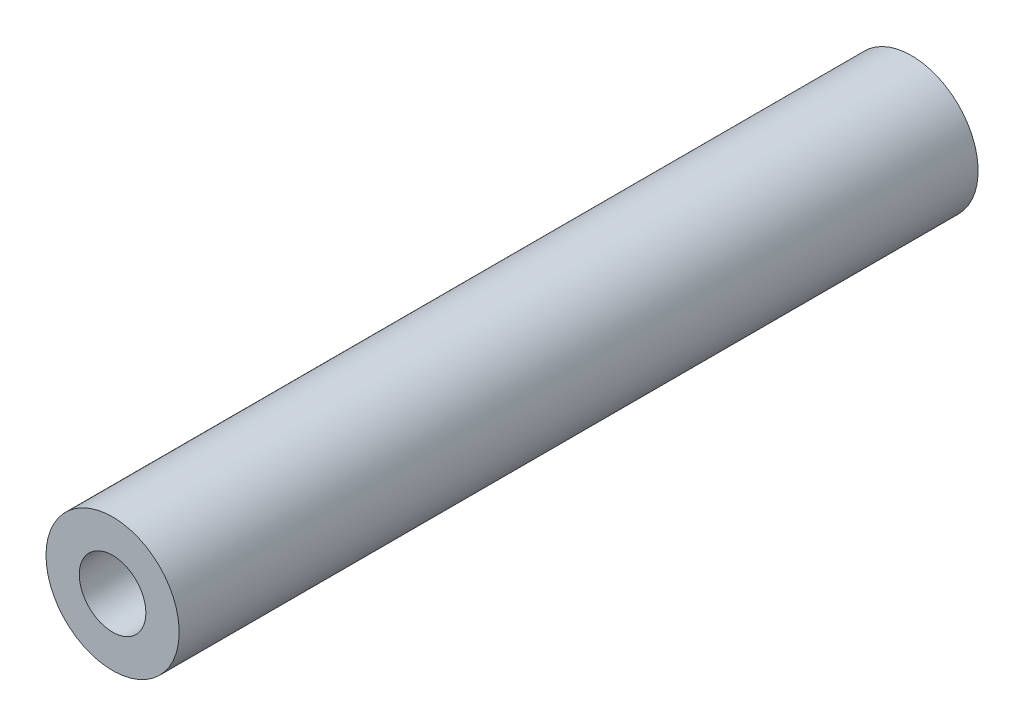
SolidWorks part; units mm, degrees
ref_plane "Front Plane" through (0, 0, 0) normal (0, 0, 1) x (1, 0, 0)
ref_plane "Top Plane" through (0, 0, 0) normal (0, 1, 0) x (1, 0, 0)
ref_plane "Right Plane" through (0, 0, 0) normal (1, 0, 0) x (0, 0, -1)
sketch "Sketch1" plane through (0, 0, 0) normal (0, 0, 1) x (1, 0, 0)
  circle A0 centre (0, 0) radius 3.175
  dimension "D1" = 6.35
extrude "Boss-Extrude1" add sketch "Sketch1" along normal blind 38.1
sketch "Sketch2" plane through (0, 0, 38.1) normal (0, 0, 1) x (1, 0, 0)
  circle A0 centre (0, 0) radius 1.5875
  dimension "D1" = 3.175
extrude "Cut-Extrude1" cut sketch "Sketch2" against normal blind 38.1
